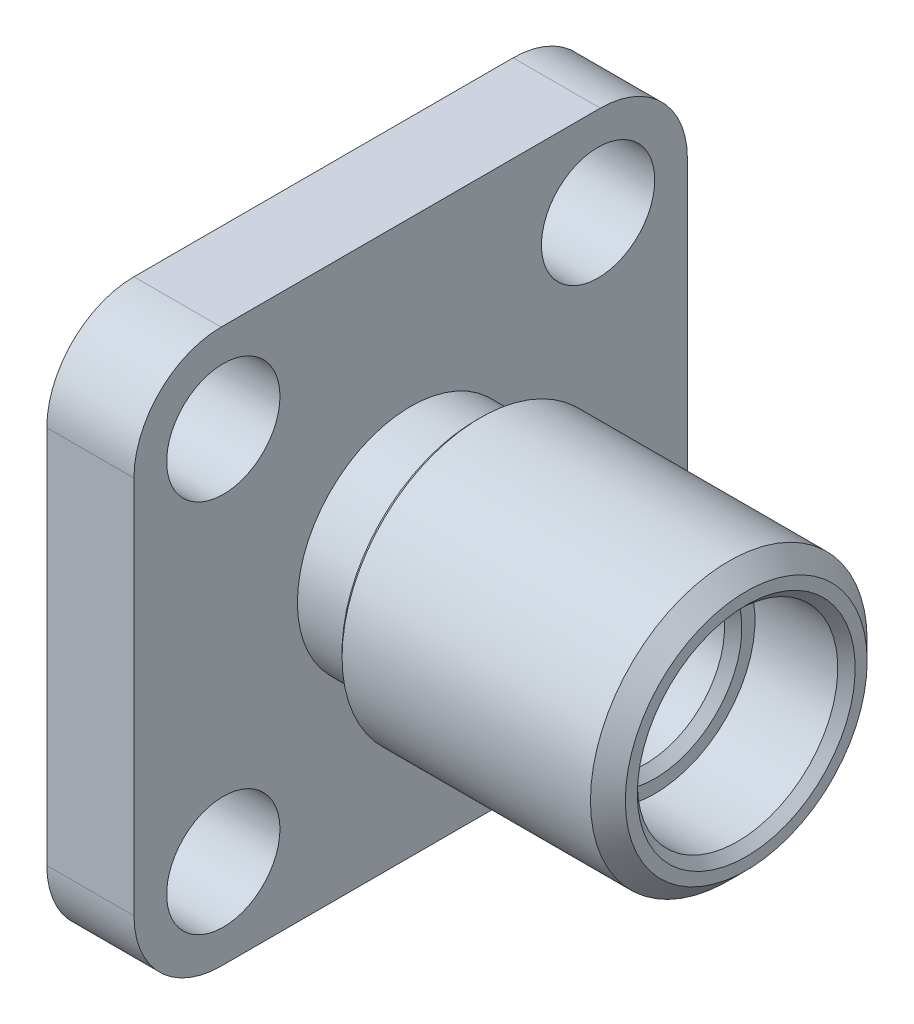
SolidWorks part; units mm, degrees
ref_plane "前视基准面" through (0, 0, 0) normal (0, 0, 1) x (1, 0, 0)
ref_plane "上视基准面" through (0, 0, 0) normal (0, 1, 0) x (1, 0, 0)
ref_plane "右视基准面" through (0, 0, 0) normal (1, 0, 0) x (0, 0, -1)
sketch "草图2" plane through (0, 0, 0) normal (0, 0, 1) x (1, 0, 0)
  line L0 (0, 0) -> (11.7634, 0) construction
  line L1 (0, 2) -> (0, 8.5)
  line L2 (0, 8.5) -> (2, 8.5)
  line L3 (2, 8.5) -> (2, 2.6)
  line L4 (2, 2.6) -> (3.5, 2.6)
  line L5 (3.5, 2.6) -> (3.5, 3.175)
  line L6 (3.5, 3.175) -> (9.7, 3.175)
  line L7 (9.7, 3.175) -> (9.7, 2.3)
  line L8 (9.7, 2.3) -> (7.6, 2.3)
  line L9 (7.6, 2.3) -> (7.6, 1.8)
  line L10 (7.6, 1.8) -> (6.5, 1.8)
  line L11 (6.5, 2) -> (6.5, 1.8)
  line L12 (6.5, 2) -> (0, 2)
  dimension "D1" = 2
  dimension "D2" = 7.6
  dimension "D3" = 8.5
  dimension "D4" = 1.8
  dimension "D5" = 7.7
  dimension "D6" = 3.175
  dimension "D7" = 1.5
  dimension "D8" = 2.3
  dimension "D9" = 2.6
  dimension "D10" = 2
  dimension "D11" = 6.5
revolve "旋转1" add sketch "草图2" angle 360 about L0
sketch "草图3" plane through (2, 0, 0) normal (1, 0, 0) x (0, 0, -1)
  line L1 (-4.35, -6.35) -> (4.35, -6.35)
  line L2 (-6.35, -4.35) -> (-6.35, 4.35)
  line L3 (-4.35, 6.35) -> (4.35, 6.35)
  line L4 (6.35, -4.35) -> (6.35, 4.35)
  line L5 (-6.35, -6.35) -> (6.35, 6.35) construction
  line L6 (-6.35, 6.35) -> (6.35, -6.35) construction
  arc A0 (-6.35, 4.35) -> (-4.35, 6.35) centre (-4.35, 4.35) cw
  arc A1 (-4.35, -6.35) -> (-6.35, -4.35) centre (-4.35, -4.35) cw
  arc A2 (4.35, -6.35) -> (6.35, -4.35) centre (4.35, -4.35) ccw
  arc A3 (4.35, 6.35) -> (6.35, 4.35) centre (4.35, 4.35) cw
  circle A4 centre (0, 0) radius 8.5
  point P0 (0, 0)
  dimension "D2" = 2
  dimension "D3" = 17
  dimension "D1" = 12.7
extrude "切除-拉伸1" cut sketch "草图3" against normal blind 2
chamfer "倒角2" distance 0.4 angle 45 1 edges at (9.7, 0, 3.175)
chamfer "倒角1" distance 0.2 angle 45 2 edges at (9.7, 0, 2.3) (7.6, 0, 1.8)
chamfer "倒角3" distance 0.1 angle 45 3 edges at (3.5, 0, 3.175) (6.5, 0, 1.8) (0, 0, 2)
sketch "草图4" plane through (2, 0, 0) normal (1, 0, 0) x (0, 0, -1)
  line L1 (-4.3, -4.3) -> (4.3, -4.3) construction
  line L2 (-4.3, -4.3) -> (-4.3, 4.3) construction
  line L3 (-4.3, 4.3) -> (4.3, 4.3) construction
  line L4 (4.3, -4.3) -> (4.3, 4.3) construction
  line L5 (-4.3, -4.3) -> (4.3, 4.3) construction
  line L6 (-4.3, 4.3) -> (4.3, -4.3) construction
  point P0 (0, 0)
  dimension "D1" = 8.6
  dimension "D2" = 8.6
hole_wizard "Ø2.6 (2.6) 直径孔1" positions "草图5" profile "草图6" hole size "Ø2.6" standard "GB"
sketch "草图5" plane through (2, 0, 0) normal (1, 0, 0) x (0, 0, -1)
  point P0 (-4.3, 4.3)
  point P3 (4.3, 4.3)
  point P6 (4.3, -4.3)
  point P9 (-4.3, -4.3)
sketch "草图6" plane through (2, 4.3, 4.3) normal (0, 1, 0) x (0, 0, -1)
  line L0 (0, 0) -> (0, 2)
  line L1 (0, 2) -> (1.3, 2)
  line L2 (1.3, 2) -> (1.3, 0)
  line L5 (1.3, 0) -> (0, 0)
  line L11 (0, -6.35) -> (0, 107.95) construction
  dimension "通孔孔直径" = 2.6
  dimension "通孔孔深度" = 2
